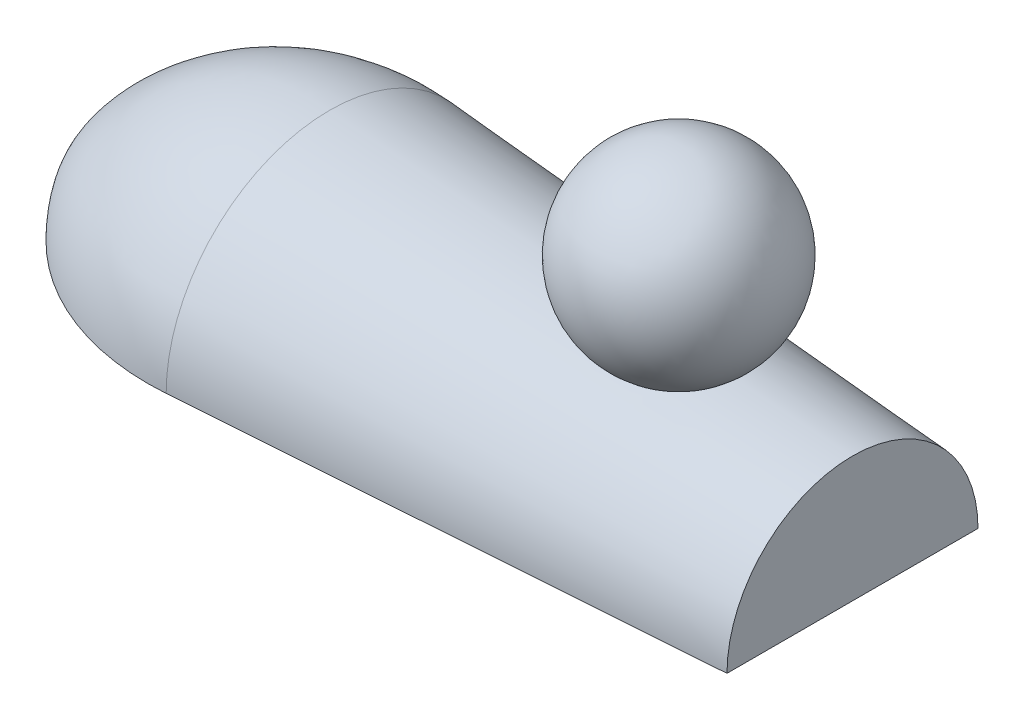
SolidWorks part; units mm, degrees
ref_plane "Přední" through (0, 0, 0) normal (0, 0, 1) x (1, 0, 0)
ref_plane "Horní" through (0, 0, 0) normal (0, 1, 0) x (1, 0, 0)
ref_plane "Pravá" through (0, 0, 0) normal (1, 0, 0) x (0, 0, -1)
sketch "Skica1" plane through (0, 0, 0) normal (0, 0, 1) x (1, 0, 0)
  line L0 (0, 28.75) -> (0, -28.75)
  line L1 (0, 0) -> (28.75, 0) construction
  line L2 (0, 28.75) -> (-13.447, 28.75) construction
  arc A0 (0, 28.75) -> (0, -28.75) centre (0, 0) cw
  dimension "D1" = 28.75
revolve "Otočit kolem osy1" add sketch "Skica1" angle 360 about L0
ref_plane "Rovina1" through (0, -63.25, 0) normal (0, 1, 0) x (-1, 0, 0)
sketch "Skica2" plane through (0, -63.25, 0) normal (0, 1, 0) x (-1, 0, 0)
  line L0 (-51.75, 0) -> (178.25, 0)
  line L1 (-51.75, 0) -> (-51.75, 37.375)
  line L2 (-51.75, 37.375) -> (103.9519, 48.6829)
  line L3 (109.25, 0) -> (109.25, 48.875) construction
  arc A0 (103.9519, 48.6829) -> (178.25, 0) centre (109.25, -24.2684) cw
  dimension "D1" = 230
  dimension "D2" = 37.375
  dimension "D3" = 51.75
  dimension "D4" = 48.875
  dimension "D5" = 161
revolve "Otočit kolem osy2" add sketch "Skica2" angle 180 about L0
